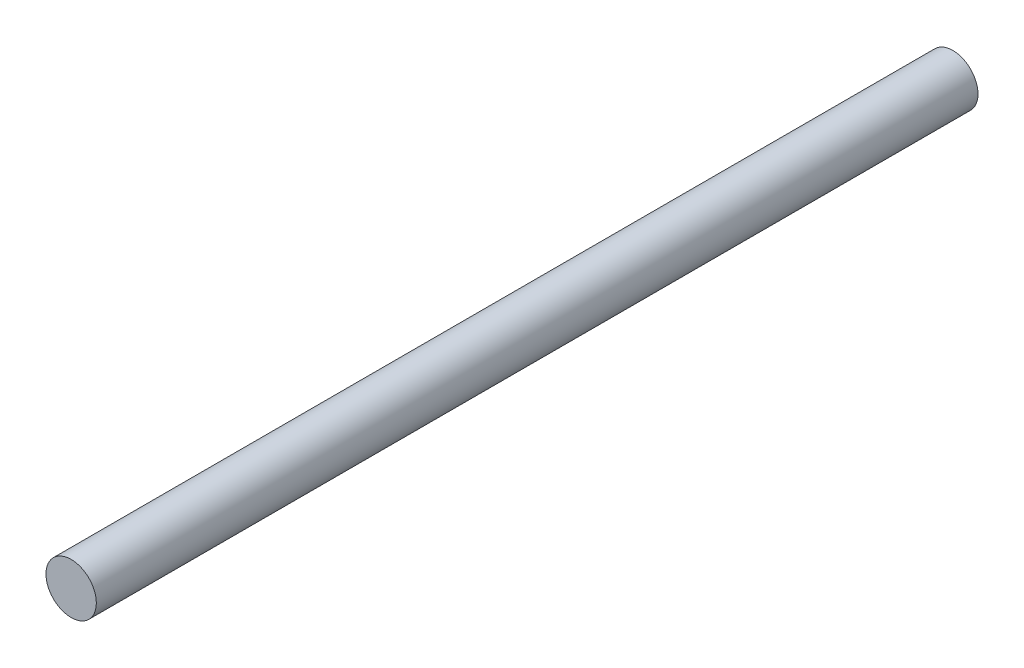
SolidWorks part; units mm, degrees
ref_plane "Front Plane" through (0, 0, 0) normal (0, 0, 1) x (1, 0, 0)
ref_plane "Top Plane" through (0, 0, 0) normal (0, 1, 0) x (1, 0, 0)
ref_plane "Right Plane" through (0, 0, 0) normal (1, 0, 0) x (0, 0, -1)
sketch "Sketch1" plane through (0, 0, 0) normal (0, 0, 1) x (1, 0, 0)
  circle A0 centre (0, 0) radius 30
  dimension "D1" = 60
extrude "Boss-Extrude1" add sketch "Sketch1" against normal blind 1050
